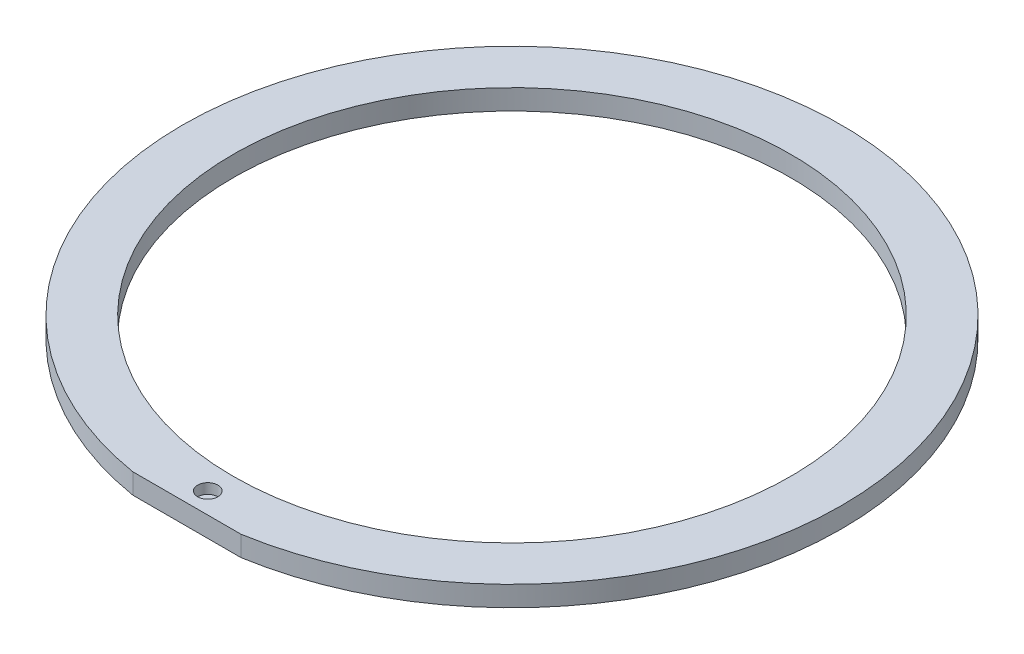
SolidWorks part; units mm, degrees
ref_plane "Front Plane" through (0, 0, 0) normal (0, 0, 1) x (1, 0, 0)
ref_plane "Top Plane" through (0, 0, 0) normal (0, 1, 0) x (1, 0, 0)
ref_plane "Right Plane" through (0, 0, 0) normal (1, 0, 0) x (0, 0, -1)
body saved out of another part "Stock-prototype 2-1"
